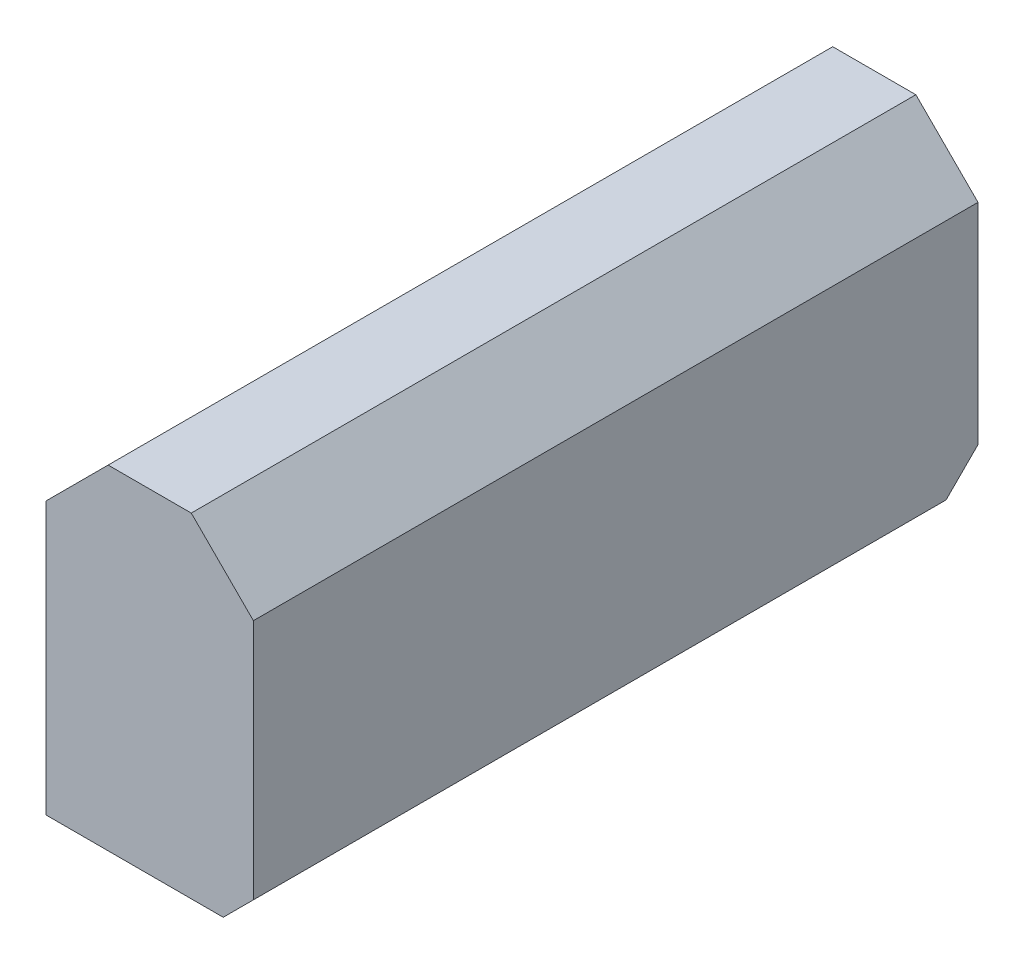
SolidWorks part; units mm, degrees
ref_plane "Front Plane" through (0, 0, 0) normal (1, 0, 0) x (0, 1, 0)
ref_plane "Top Plane" through (0, 0, 0) normal (0, 0, 1) x (0, 1, 0)
ref_plane "Right Plane" through (0, 0, 0) normal (0, 1, 0) x (-1, 0, 0)
sketch "sk w193" plane through (0, 0, 0) normal (0, 0, 1) x (0, 1, 0)
  point P0 (-199.517, -196.596)
  point P2 (0, -196.596)
  point P3 (11.303, 0)
  line B0 (-199.517, -196.596) -> (-199.517, -160.02)
  line B1 (-199.517, -160.02) -> (-26.543, -160.02)
  line B2 (-11.303, -144.78) -> (-11.303, 144.78)
  line B3 (-26.543, 160.02) -> (-199.517, 160.02)
  line B4 (-199.517, 160.02) -> (-199.517, 196.596)
  line B5 (-199.517, 196.596) -> (199.517, 196.596)
  line B6 (199.517, 196.596) -> (199.517, 160.02)
  line B7 (199.517, 160.02) -> (26.543, 160.02)
  line B8 (11.303, 144.78) -> (11.303, -144.78)
  line B9 (26.543, -160.02) -> (199.517, -160.02)
  line B10 (199.517, -160.02) -> (199.517, -196.596)
  line B11 (199.517, -196.596) -> (-199.517, -196.596)
  arc B12 (-26.543, -160.02) -> (-11.303, -144.78) centre (-26.543, -144.78) ccw
  arc B13 (-11.303, 144.78) -> (-26.543, 160.02) centre (-26.543, 144.78) ccw
  arc B14 (26.543, 160.02) -> (11.303, 144.78) centre (26.543, 144.78) ccw
  arc B15 (11.303, -144.78) -> (26.543, -160.02) centre (26.543, -144.78) ccw
sketch_block_instance "w14x193-2"
sketch_block "w14x193" parameters "D4"=15.24, "D1"=399.034, "D2"=393.192, "D3"=22.606, "D5"=36.576
sketch "Sketch2" plane through (0, 0, 0) normal (0, 0, 1) x (0, 1, 0)
  line L1 (-94.107, 58.42) -> (94.107, 58.42)
  line L2 (-94.107, 58.42) -> (-94.107, -58.42)
  line L3 (-94.107, -58.42) -> (94.107, -58.42)
  line L4 (94.107, 58.42) -> (94.107, -58.42)
  line L5 (-94.107, 58.42) -> (94.107, -58.42) construction
  line L6 (-94.107, -58.42) -> (94.107, 58.42) construction
  point P0 (0, 0)
  dimension "D1" = 116.84
  dimension "D2" = 188.214
extrude "Boss-Extrude1" add sketch "Sketch2" along normal mid plane 408.207
chamfer "Chamfer1" distance 17 angle 45 1 edges at (58.42, -94.107, 0)
chamfer "Chamfer2" distance 35 angle 45 2 edges at (-58.42, 94.107, 0) (58.42, 94.107, 0)
chamfer "Chamfer3" distance 35 angle 45 1 edges at (-8.5, -94.107, -204.1035)
